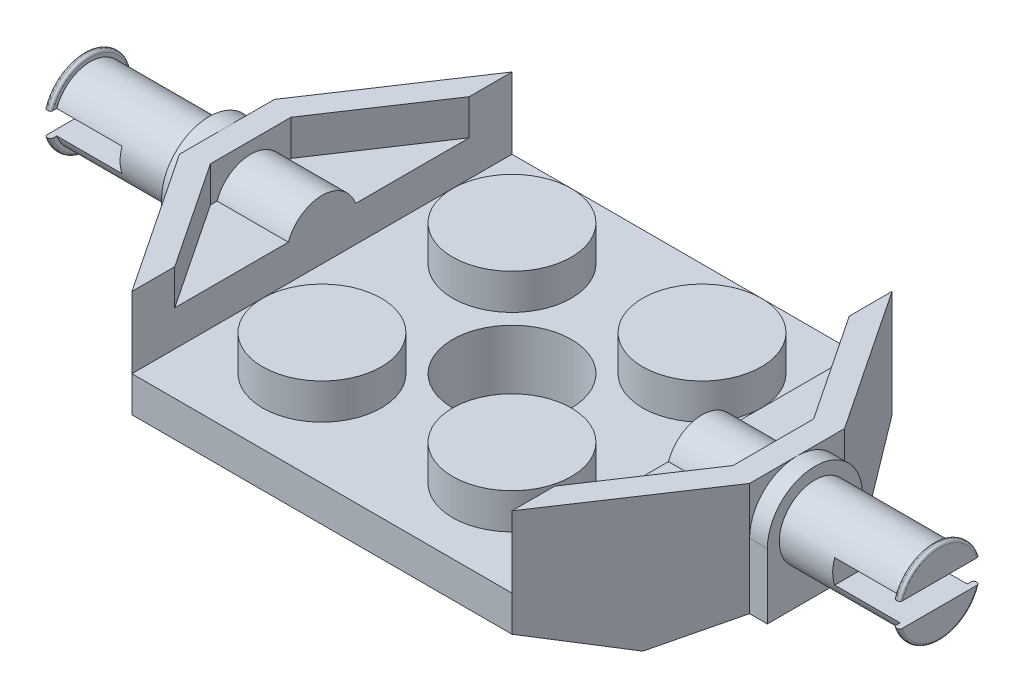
SolidWorks part; units mm, degrees
ref_plane "Face" through (0, 0, 0) normal (0, 0, 1) x (1, 0, 0)
ref_plane "Dessus" through (0, 0, 0) normal (0, 1, 0) x (1, 0, 0)
ref_plane "Droite" through (0, 0, 0) normal (1, 0, 0) x (0, 0, -1)
sketch "Esquisse1" plane through (0, 0, 0) normal (0, 1, 0) x (1, 0, 0)
  line L1 (-8, 8) -> (8, 8)
  line L2 (-8, 8) -> (-8, -8)
  line L3 (-8, -8) -> (8, -8)
  line L4 (8, 8) -> (8, -8)
  dimension "D1" = 16
  dimension "D2" = 16
  dimension "D3" = 8
  dimension "D4" = 8
extrude "Extrusion1" add sketch "Esquisse1" against normal blind 3
sketch "Esquisse2" plane through (0, -3, 0) normal (0, -1, 0) x (1, 0, 0)
  line L1 (-8, 8) -> (8, 8) construction
  line L2 (-7, 8) -> (7, 8)
  line L3 (-7, 8) -> (-7, 0.5)
  line L4 (-7, -8) -> (7, -8)
  line L8 (7, 8) -> (7, 0.5)
  line L9 (8, -8) -> (-8, -8) construction
  line L10 (-8, -8) -> (-8, 8) construction
  line L11 (8, 8) -> (8, -8) construction
  line L12 (2.8312, 0.5) -> (7, 0.5)
  line L13 (2.8312, -0.5) -> (7, -0.5)
  line L14 (-2.8312, 0.5) -> (-7, 0.5)
  line L15 (-2.8312, -0.5) -> (-7, -0.5)
  line L16 (-7, -0.5) -> (-7, -8)
  line L17 (7, -0.5) -> (7, -8)
  arc A0 (-2.8312, -0.5) -> (2.8312, -0.5) centre (0, 0) ccw
  circle A1 centre (0, 0) radius 2.5
  arc A2 (2.8312, 0.5) -> (-2.8312, 0.5) centre (0, 0) ccw
  dimension "D3" = 5
  dimension "D4" = 5.75
  dimension "D1" = 1
  dimension "D2" = 1
  dimension "D5" = 7.5
  dimension "D6" = 1
extrude "Enlèv. mat.-Extru.1" cut sketch "Esquisse2" against normal blind 1.5
sketch "Esquisse3" plane through (0, 0, 0) normal (0, 1, 0) x (-1, 0, 0)
  line L0 (8, 8) -> (-8, 8) construction
  line L1 (8, -8) -> (8, 8) construction
  line L2 (-8, -8) -> (8, -8) construction
  line L3 (-8, 8) -> (-8, -8) construction
  circle A0 centre (-4, -4) radius 2.5
  circle A1 centre (4, 4) radius 2.5
  circle A2 centre (-4, 4) radius 2.5
  circle A3 centre (4, -4) radius 2.5
  dimension "D1" = 5
  dimension "D6" = 5
  dimension "D7" = 5
  dimension "D8" = 5
  dimension "D2" = 4
  dimension "D3" = 4
  dimension "D4" = 4
  dimension "D5" = 4
extrude "Extrusion2" add sketch "Esquisse3" along normal blind 1.5
sketch "Esquisse5" plane through (0, -1.5, 0) normal (0, -1, 0) x (1, 0, 0)
  circle A0 centre (0, 0) radius 2.5
extrude "Enlèv. mat.-Extru.3" cut sketch "Esquisse5" against normal blind 1.5
sketch "Esquisse7" plane through (0, -3, 0) normal (0, -1, 0) x (1, 0, 0)
  line L0 (-12, 2) -> (-12, -2)
  line L1 (7, 8) -> (-7, 8) construction
  line L2 (-7, -8) -> (7, -8) construction
  line L3 (-8, -8) -> (-8, 8) construction
  line L4 (-12, 2) -> (-8, 8)
  line L5 (-12, -2) -> (-8, -8)
  line L6 (-8, 8) -> (-8, -8)
  dimension "D1" = 6
  dimension "D2" = 6
  dimension "D3" = 4
extrude "Extrusion3" add sketch "Esquisse7" against normal blind 6
pattern_circular "Répétition circulaire1" count 2 every 180 about axis through (0, 0, 0) along (0, 1, 0) of "Extrusion3"
sketch "Esquisse8" plane through (0, 3, 0) normal (0, 1, 0) x (-1, 0, 0)
  line L0 (11, -1.6972) -> (8, -6.1972)
  line L1 (8, -6.1972) -> (8, 6.1972)
  line L2 (11, -1.6972) -> (11, 1.6972)
  line L3 (11, 1.6972) -> (8, 6.1972)
  line L5 (8, 8) -> (12, 2) construction
  line L6 (8, -8) -> (8, 8) construction
  line L7 (12, 2) -> (12, -2) construction
  line L8 (12, -2) -> (8, -8) construction
  dimension "D1" = 180
  dimension "D2" = 180
  dimension "D3" = 1
extrude "Enlèv. mat.-Extru.4" cut sketch "Esquisse8" against normal blind 1.5
pattern_circular "Répétition circulaire2" count 2 every 180 about axis through (0, -1.5, 0) along (0, -1, 0) of "Enlèv. mat.-Extru.4"
sketch "Esquisse9" plane through (0, -3, 0) normal (0, -1, 0) x (1, 0, 0)
  line L0 (-8, 6.3089) -> (-8, -6.3042)
  line L1 (-8, 6.3089) -> (-11, 1.8089)
  line L2 (-11, 1.8089) -> (-11, -1.8042)
  line L3 (-11, -1.8042) -> (-8, -6.3042)
  line L4 (-12, -2) -> (-8, -8) construction
  line L5 (-8, 8) -> (-12, 2) construction
  line L6 (-12, 2) -> (-12, -2) construction
  dimension "D1" = 180
  dimension "D2" = 180
  dimension "D3" = 1
extrude "Enlèv. mat.-Extru.5" cut sketch "Esquisse9" against normal blind 3.25
sketch "Esquisse10" plane through (0, 0.25, 0) normal (0, -1, 0) x (1, 0, 0)
  line L0 (-8, 6.3089) -> (-8, -6.3042)
  line L1 (-8, -6.3042) -> (-9, -4.8042)
  line L2 (-11, -1.8042) -> (-8, -6.3042) construction
  line L3 (-9, -4.8042) -> (-9, 4.8089)
  line L4 (-8, 6.3089) -> (-11, 1.8089) construction
  line L5 (-9, 4.8089) -> (-8, 6.3089)
  dimension "D1" = 1
extrude "Extrusion4" add sketch "Esquisse10" along normal up to vertex (1.75 mm away)
pattern_circular "Répétition circulaire3" count 2 every 180 about axis through (0, -1.5, 0) along (0, -1, 0) of "Enlèv. mat.-Extru.5"
pattern_circular "Répétition circulaire4" count 2 every 180 about axis through (0, -1.5, 0) along (0, 0, 1) of "Extrusion4"
sketch "Esquisse12" plane through (12, 0, 0) normal (1, 0, 0) x (0, 0, -1)
  line L0 (-8, -1.5) -> (-3.75, -3)
  line L1 (-8, -3) -> (-2, -3) construction
  line L2 (-3.75, -3) -> (3.75, -3)
  line L3 (2, -3) -> (8, -3) construction
  line L4 (3.75, -3) -> (8, -1.5)
  line L6 (-8, -1.5) -> (-8, -5.2498)
  line L7 (-8, -5.2498) -> (8, -5.2498)
  line L8 (8, -5.2498) -> (8, -1.5)
  dimension "D1" = 4.25
extrude "Enlèv. mat.-Extru.6" cut sketch "Esquisse12" against normal through all
sketch "Esquisse13" plane through (12, 0, 0) normal (1, 0, 0) x (0, 0, -1)
  line L0 (4.693, -2.6672) -> (2, -1.75)
  line L1 (8, -1.5) -> (3.75, -3) construction
  line L2 (2, 3) -> (2, -3) construction
  line L3 (2, -1.75) -> (-2, -1.75)
  line L4 (-2, 3) -> (-2, -3) construction
  line L5 (-2, -1.75) -> (-4.693, -2.6672)
  line L6 (-3.75, -3) -> (-8, -1.5) construction
  line L7 (2, -3) -> (-2, -3) construction
  line L8 (-4.693, -2.6672) -> (-3.75, -3)
  line L9 (-3.75, -3) -> (3.75, -3)
  line L10 (3.75, -3) -> (4.693, -2.6672)
  dimension "D1" = 1
  dimension "D2" = 1
  dimension "D3" = 1.25
extrude "Enlèv. mat.-Extru.7" cut sketch "Esquisse13" against normal up to vertex (4 mm away)
pattern_circular "Répétition circulaire5" count 2 every 180 about axis through (0, -1.5, 0) along (0, -1, 0) of "Enlèv. mat.-Extru.7"
sketch "Esquisse14" plane through (12, 0, 0) normal (1, 0, 0) x (0, 0, -1)
  line L0 (0, -1.5) -> (0, -3) construction
  line L5 (2, 3) -> (2, -1.75) construction
  line L6 (-2, 3) -> (-2, -1.75) construction
  line L7 (2, 3) -> (-2, 3) construction
  line L8 (2, -1.75) -> (2, 1)
  line L9 (-2, -1.75) -> (-2, 1)
  line L10 (-2, -1.75) -> (2, -1.75)
  arc A0 (2, 1) -> (-2, 1) centre (0, 1) ccw
extrude "Extrusion5" add sketch "Esquisse14" along normal blind 0.75
sketch "Esquisse17" plane through (8, 0, 0) normal (-1, 0, 0) x (0, 0, 1)
  line L0 (0, -1.5) -> (0, -3) construction
  line L1 (2, 3) -> (-2, 3) construction
  circle A0 centre (0, 1) radius 1.5
  dimension "D1" = 3
  dimension "D2" = 2
extrude "Extrusion6" add sketch "Esquisse17" against normal blind 10
pattern_circular "Répétition circulaire6" count 2 every 180 about axis through (0, 0, 0) along (0, 1, 0) of "Extrusion5"
pattern_circular "Répétition circulaire7" count 2 every 180 about axis through (0, -1.5, 0) along (0, -1, 0) of "Extrusion6"
sketch "Esquisse18" plane through (18, 0, 0) normal (1, 0, 0) x (0, 0, -1)
  line L1 (0, -1.5) -> (0, -3) construction
  line L2 (0, 3) -> (-2, 3) construction
  circle A0 centre (0, 1) radius 1.75
  dimension "D1" = 3.5
  dimension "D2" = 2
extrude "Extrusion7" add sketch "Esquisse18" against normal blind 0.25
pattern_circular "Répétition circulaire8" count 2 every 180 about axis through (0, -1.5, 0) along (0, -1, 0) of "Extrusion7"
sketch "Esquisse19" plane through (0, 0, -8) normal (0, 0, -1) x (-1, 0, 0)
  line L1 (-18, 1.5) -> (-15, 1.5)
  line L2 (-18, 2.75) -> (-18, -0.75) construction
  line L3 (-15, 1.5) -> (-15, 0.5)
  line L4 (-15, 0.5) -> (-18, 0.5)
  line L5 (-17.75, 1) -> (-12.75, 1) construction
  line L6 (-18, 1.5) -> (-18, 0.5)
  dimension "D1" = 0.5
  dimension "D2" = 1
  dimension "D3" = 3
extrude "Enlèv. mat.-Extru.8" cut sketch "Esquisse19" against normal through all
pattern_circular "Répétition circulaire9" count 2 every 180 about axis through (0, -1.5, 0) along (0, -1, 0) of "Enlèv. mat.-Extru.8"
fillet "Congé1" radius 0.1 8 edges at (17.75, 2.75, 0) (18, 2.75, 0) (-17.75, 2.75, 0) (-18, 2.75, 0) (18, -0.75, 0) (17.75, -0.75, 0) (-18, -0.75, 0) (-17.75, -0.75, 0)
